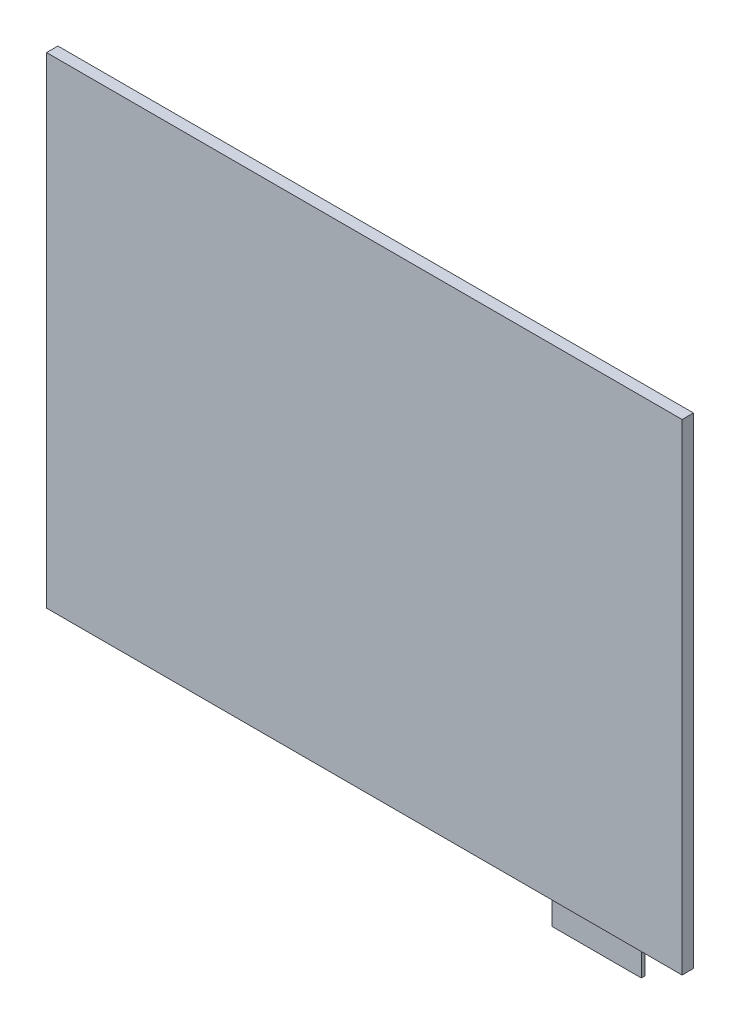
SolidWorks part; units mm, degrees
ref_plane "Front" through (0, 0, 0) normal (0, 0, 1) x (1, 0, 0)
ref_plane "Top" through (0, 0, 0) normal (0, 1, 0) x (1, 0, 0)
ref_plane "Right" through (0, 0, 0) normal (1, 0, 0) x (0, 0, -1)
sketch "Sketch1" plane through (0, 0, 0) normal (0, 0, 1) x (1, 0, 0)
  line L0 (-172.7198, 129.5403) -> (172.7198, 129.5403)
  line L1 (-172.7198, 129.5403) -> (-172.7198, -129.5403)
  line L2 (172.7198, -129.5403) -> (-172.7198, -129.5403)
  line L3 (172.7198, -129.5403) -> (172.7198, 129.5403)
  line L4 (0, 0) -> (0, 17.3361) construction
  line L5 (0, 0) -> (21.1238, 0) construction
  line L6 (172.7198, 129.5403) -> (-172.7198, -129.5403) construction
  dimension "D1" = 431.8
  dimension "ScreenWidth" = 345.4395
  dimension "ScreenHeight" = 259.0806
  dimension "D4" = 36.87
sketch "Sketch2" plane through (0, 0, 0) normal (0, 0, 1) x (1, 0, 0)
  line L4 (-177.7198, 134.5403) -> (-177.7198, -134.5403)
  line L5 (177.7198, -134.5403) -> (-177.7198, -134.5403)
  line L6 (177.7198, -134.5403) -> (177.7198, 134.5403)
  line L7 (-177.7198, 134.5403) -> (177.7198, 134.5403)
  line L8 (-177.7198, 134.5403) -> (-177.7198, -134.5403)
  line L9 (177.7198, -134.5403) -> (-177.7198, -134.5403)
  line L10 (177.7198, -134.5403) -> (177.7198, 134.5403)
  line L11 (-177.7198, 134.5403) -> (177.7198, 134.5403)
  dimension "D1" = 5
extrude "Base-Extrude" add sketch "Sketch2" along normal blind 6.35
sketch "Sketch3" plane through (43.1795, -134.5403, 0) normal (0, 1, 0) x (0, 0, -1)
  line L0 (-4.175, -59.5403) -> (-2.175, -59.5403)
  line L1 (-4.175, -59.5403) -> (-4.175, -109.5403)
  line L2 (-2.175, -109.5403) -> (-4.175, -109.5403)
  line L3 (-2.175, -109.5403) -> (-2.175, -59.5403)
  line L4 (-3.175, -134.5403) -> (-3.175, -186.5483) construction
  line L6 (-6.35, -134.5403) -> (0, -134.5403) construction
  line L7 (-6.35, -134.5403) -> (0, -134.5403) construction
  dimension "D1" = 2
  dimension "D2" = 50
  dimension "D3" = 25
extrude "Connector" add sketch "Sketch3" against normal blind 15
equation "\"ScreenWidth@Sketch1\" = \"ScreenHeight@Sketch1\"*(640/480)"
